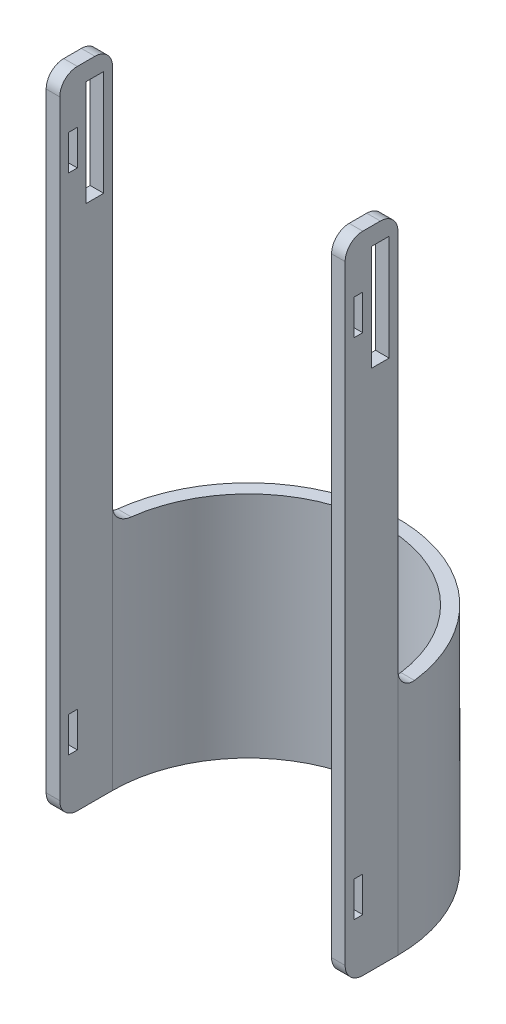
SolidWorks part; units mm, degrees
other "Markup1"
sketch "Sketch11" plane through (-75, 302.2666, -81.3292) normal (-0.1024, 0.768, -0.6322) x (-0.9876, -0.0025, 0.157)
ref_plane "Front Plane" through (0, 0, 0) normal (0, 0, 1) x (1, 0, 0)
ref_plane "Top Plane" through (0, 0, 0) normal (0, 1, 0) x (1, 0, 0)
ref_plane "Right Plane" through (0, 0, 0) normal (1, 0, 0) x (0, 0, -1)
sketch "Sketch1" plane through (0, 0, 0) normal (0, 1, 0) x (1, 0, 0)
  line L0 (-85, 0) -> (85, 0) construction
  line L1 (-77.2727, 0) -> (-85, 0)
  line L2 (85, 0) -> (77.2727, 0)
  arc A0 (85, 0) -> (-85, 0) centre (0, 0) ccw
  arc A1 (77.2727, 0) -> (-77.2727, 0) centre (0, 0) ccw
extrude "Boss-Extrude1" add sketch "Sketch1" along normal blind 130.0689
sketch "Sketch2" plane through (0, 0, 0) normal (0, 0, 1) x (1, 0, 0)
  line L1 (77.2727, 130.0689) -> (85, 130.0689)
  line L2 (77.2727, 130.0689) -> (77.2727, 0)
  line L3 (77.2727, 0) -> (85, 0)
  line L4 (85, 130.0689) -> (85, 0)
  line L5 (-85, 130.0689) -> (-77.2727, 130.0689)
  line L6 (-85, 130.0689) -> (-85, 0)
  line L7 (-85, 0) -> (-77.2727, 0)
  line L8 (-77.2727, 130.0689) -> (-77.2727, 0)
extrude "Boss-Extrude2" add sketch "Sketch2" along normal blind 30
sketch "Sketch3" plane through (0, 130.0689, 0) normal (0, 1, 0) x (1, 0, 0)
  line L1 (-77.2727, -30) -> (-85, -30)
  line L2 (-77.2727, -30) -> (-77.2727, 0)
  line L3 (-77.2727, 0) -> (-85, 0)
  line L4 (-85, -30) -> (-85, 0)
  line L5 (85, -30) -> (77.2727, -30)
  line L6 (85, -30) -> (85, 0)
  line L7 (85, 0) -> (77.2727, 0)
  line L8 (77.2727, -30) -> (77.2727, 0)
extrude "Boss-Extrude3" add sketch "Sketch3" along normal blind 236.5
sketch "Sketch5" plane through (-85, 0, 0) normal (-1, 0, 0) x (0, 0, 1)
  line L0 (0, 366.5689) -> (30, 366.5689) construction
  line L1 (5, 356.5689) -> (15, 356.5689)
  line L2 (5, 356.5689) -> (5, 296.5689)
  line L3 (5, 296.5689) -> (15, 296.5689)
  line L4 (15, 356.5689) -> (15, 296.5689)
  line L5 (0, 366.5689) -> (0, 130.0689) construction
  dimension "D1" = 60
  dimension "D2" = 10
  dimension "D3" = 10
  dimension "D4" = 5
extrude "Cut-Extrude1" cut sketch "Sketch5" against normal blind 240
sketch "Sketch6" plane through (-85, 0, 0) normal (-1, 0, 0) x (0, 0, 1)
  line L0 (17.5605, 360) -> (17.5605, 300) construction
  line L1 (20, 336.5689) -> (25, 336.5689)
  line L2 (20, 336.5689) -> (20, 316.5689)
  line L3 (20, 316.5689) -> (25, 316.5689)
  line L4 (25, 336.5689) -> (25, 316.5689)
  line L5 (15, 356.5689) -> (5, 356.5689) construction
  line L7 (15, 296.5689) -> (15, 356.5689) construction
  dimension "D1" = 20
  dimension "D2" = 5
  dimension "D3" = 20
  dimension "D4" = 5
extrude "Cut-Extrude2" cut sketch "Sketch6" against normal through all
fillet "Fillet1" radius 10 4 edges at (81.1364, 366.5689, 30) (-81.1364, 366.5689, 30) (-81.1364, 366.5689, 0) (81.1364, 366.5689, 0)
fillet "Fillet2" radius 10 2 edges at (81.1364, 0, 30) (-81.1364, 0, 30)
fillet "Fillet3" radius 10 2 edges at (81.1364, 130.0689, 0) (-81.1364, 130.0689, 0)
sketch "Sketch8" plane through (-85, 0, 0) normal (-1, 0, 0) x (0, 0, 1)
  line L1 (20, 50) -> (25, 50)
  line L2 (20, 50) -> (20, 30)
  line L3 (20, 30) -> (25, 30)
  line L4 (25, 50) -> (25, 30)
  line L5 (20, 0) -> (0, 0) construction
  line L6 (30, 356.5689) -> (30, 10) construction
  dimension "D1" = 20
  dimension "D2" = 5
  dimension "D3" = 30
  dimension "D4" = 5
extrude "Cut-Extrude3" cut sketch "Sketch8" against normal through all
ref_plane "Plane1" through (0, 65.0689, 0) normal (0, 1, 0) x (1, 0, 0)
sketch "Sketch9" plane through (0, 65.0689, 0) normal (0, 1, 0) x (1, 0, 0)
  line L0 (-26.2664, 80.8398) -> (-26.2664, 90.8398)
  line L1 (-26.2664, 90.8398) -> (26.2664, 90.8398)
  line L2 (26.2664, 90.8398) -> (26.2664, 80.8398)
  line L3 (-85, 0) -> (85, 0)
  line L4 (0, 0) -> (-26.2664, 80.8398) construction
  line L5 (0, 0) -> (26.2664, 80.8398) construction
  arc A0 (84.4097, 10) -> (-84.4097, 10) centre (0, 0) ccw construction
  arc A1 (85, 0) -> (-26.2664, 80.8398) centre (0, 0) ccw
  point P13 (0, 0)
  dimension "D1" = 72
  dimension "D2" = 72
  dimension "D3" = 10
  dimension "D4" = 10
extrude "Boss-Extrude4" add sketch "Sketch9" along normal mid plane 60 contours A1 L2 L1 L0
fillet "Fillet4" radius 5 4 edges at (0, 35.0689, -90.8398) (26.2664, 65.0689, -90.8398) (-26.2664, 65.0689, -90.8398) (0, 95.0689, -90.8398)
sketch "Sketch10" plane through (0, 0, -90.8398) normal (0, 0, -1) x (-1, 0, 0)
  line L0 (21.2664, 90.0689) -> (-21.2664, 90.0689) construction
  line L1 (-21.2664, 90.0689) -> (-21.2664, 40.0689) construction
  line L2 (21.2664, 40.0689) -> (21.2664, 90.0689) construction
  line L3 (21.2664, 90.0689) -> (-21.2664, 90.0689) construction
  line L4 (-21.2664, 40.0689) -> (21.2664, 40.0689) construction
  line L5 (-21.2664, 40.0689) -> (21.2664, 40.0689) construction
  circle A0 centre (-16.2664, 85.0689) radius 1.0922
  circle A1 centre (16.2664, 85.0689) radius 1.0922
  circle A2 centre (-16.2664, 45.0689) radius 1.0922
  circle A3 centre (16.2664, 45.0689) radius 1.0922
  dimension "D1" = 2.1844
  dimension "D2" = 2.1844
  dimension "D3" = 2.1844
  dimension "D4" = 2.1844
  dimension "D5" = 5
  dimension "D7" = 5
  dimension "D8" = 5
  dimension "D9" = 5
  dimension "D10" = 5
  dimension "D11" = 5
  dimension "D12" = 5
  dimension "D6" = 5
extrude "Cut-Extrude4" cut sketch "Sketch10" against normal blind 5
equation "\"userHeight\"= 1700mm'Users height"
equation "\"shellLength\"= \"userHeight\" / 13.07'Shell Length"
equation "\"D1@Boss-Extrude1\"=\"shellLength\""
equation "\"partialSidebarLength\"= \"userHeight\" * 0.245 - 180'Sidebar length - minus constant"
equation "\"shell_outer_radius\"= \"userHeight\" / 20'Shell outer radius"
equation "\"D2@Sketch1\"=\"shell_outer_radius\""
equation "\"shell_inner_radius\"= \"userHeight\" / 22'Shell inner radius"
equation "\"D1@Sketch1\"=\"shell_inner_radius\""
equation "\"fin_platform_extrusion\"= 60 * \"userHeight\" / 1700'Fin platform height"
equation "\"D1@Boss-Extrude4\"=\"fin_platform_extrusion\""
equation "\"D1@Boss-Extrude3\"=\"partialSidebarLength\""
